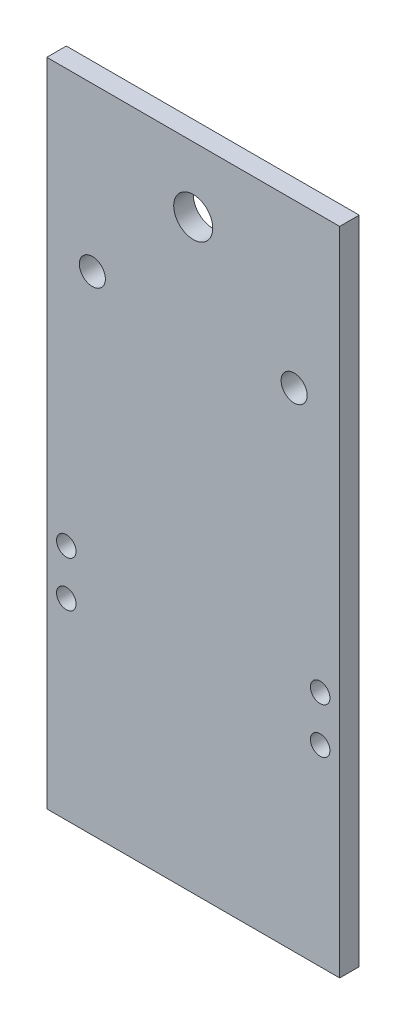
SolidWorks part; units mm, degrees
ref_plane "Plan de face" through (0, 0, 0) normal (0, 0, 1) x (1, 0, 0)
ref_plane "Plan de dessus" through (0, 0, 0) normal (0, 1, 0) x (1, 0, 0)
ref_plane "Plan de droite" through (0, 0, 0) normal (1, 0, 0) x (0, 0, -1)
sketch "Esquisse1" plane through (0, 0, 0) normal (0, 0, 1) x (1, 0, 0)
  line L0 (-26.4582, -43.8926) -> (12.5418, -43.8926) construction
  line L1 (-29.4582, 26.6074) -> (15.5418, 26.6074)
  line L2 (-29.4582, 26.6074) -> (-29.4582, -73.3926)
  line L3 (-29.4582, -73.3926) -> (15.5418, -73.3926)
  line L4 (15.5418, 26.6074) -> (15.5418, -73.3926)
  line L5 (-26.4582, -43.8926) -> (-26.4582, -36.8926) construction
  circle A0 centre (-6.9582, 16.6074) radius 3
  circle A1 centre (8.5418, 1.6074) radius 2
  circle A2 centre (-22.4582, 1.6074) radius 2
  circle A3 centre (-26.4582, -43.8926) radius 1.5
  circle A4 centre (12.5418, -43.8926) radius 1.5
  circle A5 centre (-26.4582, -36.8926) radius 1.5
  circle A6 centre (12.5418, -36.8926) radius 1.5
  dimension "D3" = 6
  dimension "D4" = 10
  dimension "D5" = 22.5
  dimension "D6" = 25
  dimension "D7" = 25
  dimension "D10" = 4
  dimension "D11" = 4
  dimension "D12" = 3
  dimension "D14" = 3
  dimension "D1" = 45
  dimension "D2" = 100
  dimension "D8" = 7
  dimension "D9" = 7
  dimension "D13" = 29.5
  dimension "D15" = 90
extrude "Extrusion1" add sketch "Esquisse1" along normal blind 3
